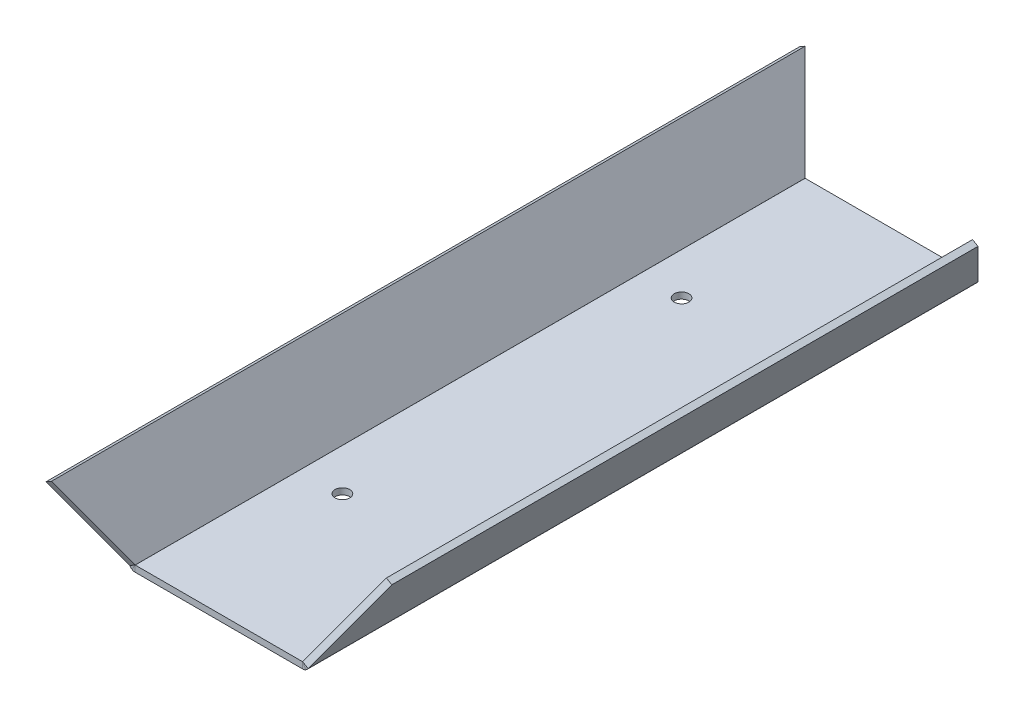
SolidWorks part; units mm, degrees
ref_plane "Front Plane" through (0, 0, 0) normal (0, 0, 1) x (1, 0, 0)
ref_plane "Top Plane" through (0, 0, 0) normal (0, 1, 0) x (1, 0, 0)
ref_plane "Right Plane" through (0, 0, 0) normal (1, 0, 0) x (0, 0, -1)
sketch "Sketch1" plane through (0, 0, 0) normal (0, 1, 0) x (1, 0, 0)
  line L0 (0, 0) -> (80, 0) construction
  line L1 (0, -90) -> (0, 90)
  line L2 (0, 90) -> (20, 80)
  line L3 (20, 80) -> (60, 80)
  line L4 (60, 80) -> (80, 70)
  line L5 (80, 70) -> (80, -70)
  line L6 (60, -80) -> (80, -70)
  line L7 (20, -80) -> (60, -80)
  line L8 (0, -90) -> (20, -80)
  circle A0 centre (30, 40.5) radius 1.75
  circle A1 centre (30, -40.5) radius 1.75
  dimension "D7" = 30
  dimension "D9" = 3.5
  dimension "D1" = 20
  dimension "D2" = 20
  dimension "D3" = 40
  dimension "D4" = 10
  dimension "D5" = 10
  dimension "D6" = 40.5
  dimension "D8" = 80
sheet metal parameters "Sheet-Metal1" thickness 1.5 parameters "D1"=1
base flange "Base-Flange1" sketch "Sketch1" thickness 1.5 reverse thickness direction yes parameters "D1"=1
sketch "Sketch3" plane through (0, 1.5, 0) normal (0, 1, 0) x (1, 0, 0)
  line L0 (60, 80) -> (60, -80)
sketched bend "Sketched Bend1" parameters "D1"=0.01
bend "SketchBend1" bend radius 0.01 bend angle 60 parameters "D5"=1
sketch "Sketch4" plane through (0, 1.5, 0) normal (0, 1, 0) x (1, 0, 0)
  line L0 (20, 80) -> (20, -80)
  line L1 (20, -80) -> (59.9948, -80) construction
  line L2 (0, -90) -> (20, -80) construction
sketched bend "Sketched Bend2" parameters "D1"=0.01
bend "SketchBend2" bend radius 0.01 bend angle 60 parameters "D5"=2
flat pattern "Flat-Pattern1"
sketch "Bend-Lines1" plane through (0, 0, 0) normal (0, 1, 0) x (-1, 0, 0)
bend of the flat pattern "Flatten-<SketchBend1>1"
bend of the flat pattern "Flatten-<SketchBend2>1"
